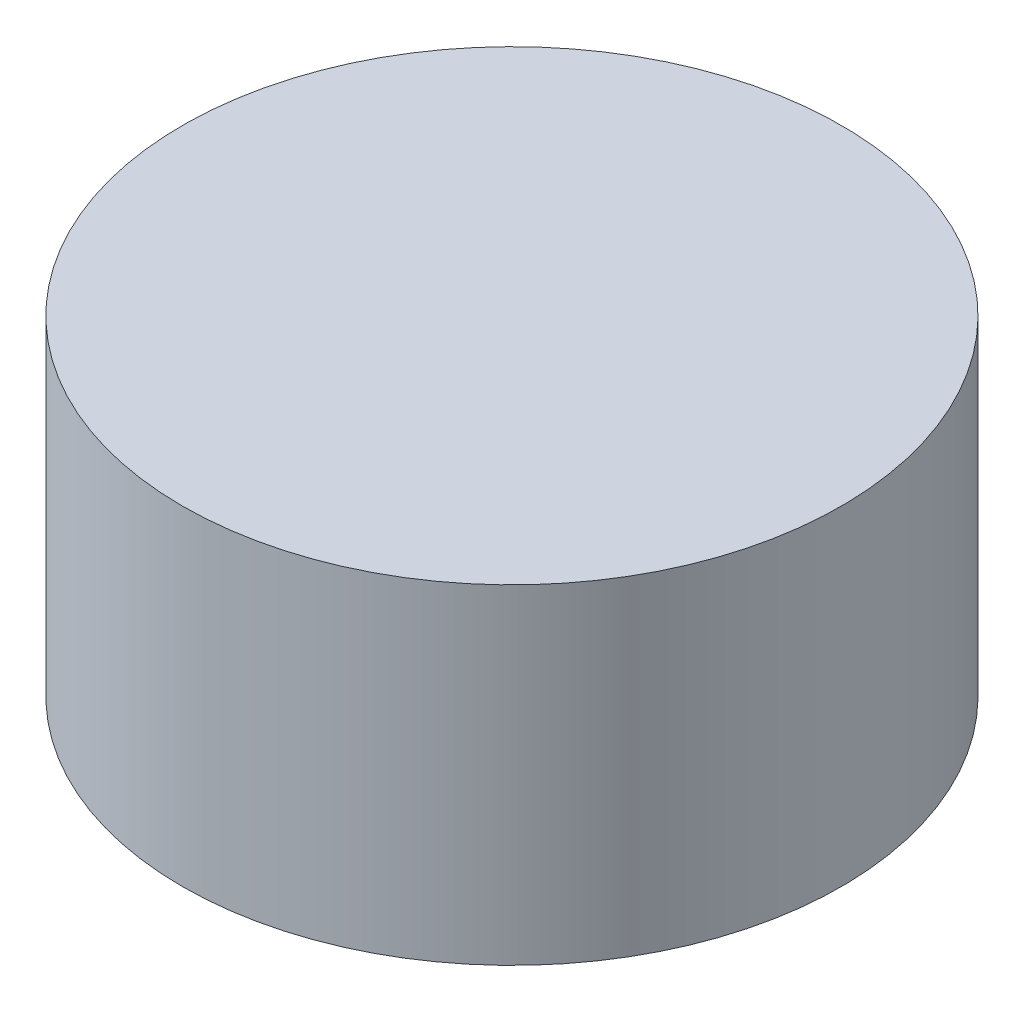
SolidWorks part; units mm, degrees
ref_plane "Front Plane" through (0, 0, 0) normal (0, 0, 1) x (1, 0, 0)
ref_plane "Top Plane" through (0, 0, 0) normal (0, 1, 0) x (1, 0, 0)
ref_plane "Right Plane" through (0, 0, 0) normal (1, 0, 0) x (0, 0, -1)
sketch "Sketch1" plane through (0, 0, 0) normal (0, 0, 1) x (1, 0, 0)
  line L0 (14.8295, 3) -> (14.8278, 0)
  line L1 (14.8278, 0) -> (19.8278, 0)
  line L2 (4.8278, 0) -> (4.8278, 13) construction
  line L4 (18.8278, 3) -> (17.8278, 3)
  line L6 (4.8278, 10.13) -> (4.8278, 13)
  line L8 (18.8278, 3) -> (19.8278, 0)
  line L12 (7.6978, 2.87) -> (14.8278, 2.87) construction
  line L13 (14.8278, 2.87) -> (14.8734, 2.87) construction
  line L14 (14.8734, 2.87) -> (14.8734, 2.87) construction
  line L15 (14.8734, 2.87) -> (14.8734, 2.87) construction
  line L16 (7.6978, 2.87) -> (7.6978, 9.7333) construction
  line L17 (4.8278, 0) -> (14.8278, 0) construction
  arc A0 (4.8278, 13) -> (17.8278, 3) centre (4.8278, -0.45) cw
  arc A1 (4.8278, 10.13) -> (14.8295, 3) centre (4.8278, -0.45) cw
  arc A2 (7.6978, 9.7333) -> (14.8734, 2.87) centre (4.8278, -0.45) cw construction
revolve "Revolve1" add sketch "Sketch1" angle 360 about L6
scale "Scale1" scale about centroid uniform scaling yes scale factor 1
other "Parting Line1"
other "Parting Surface1" parameters "D1"=11.1
sketch "Sketch2" plane through (0, 0, 0) normal (0, 1, 0) x (1, 0, 0)
  line L0 (4.8278, 0) -> (14.8295, 0) construction
  line L1 (4.8278, 0) -> (17.8278, 0) construction
  circle A0 centre (4.8278, 0) radius 20
  dimension "D1" = 40
other "Tooling Split1" parameters "D1"=10, "D2"=20, "D3"=3
move or copy body "Body-Move/Copy5" bodies to move or copy 108 copy no translate (0, -34.4321, 0)
move or copy body "Body-Move/Copy6" bodies to move or copy 103 copy no translate (0, -22.2088, 0)
delete or keep bodies "Body-Delete/Keep 2" type delete bodies bodies 113 114
